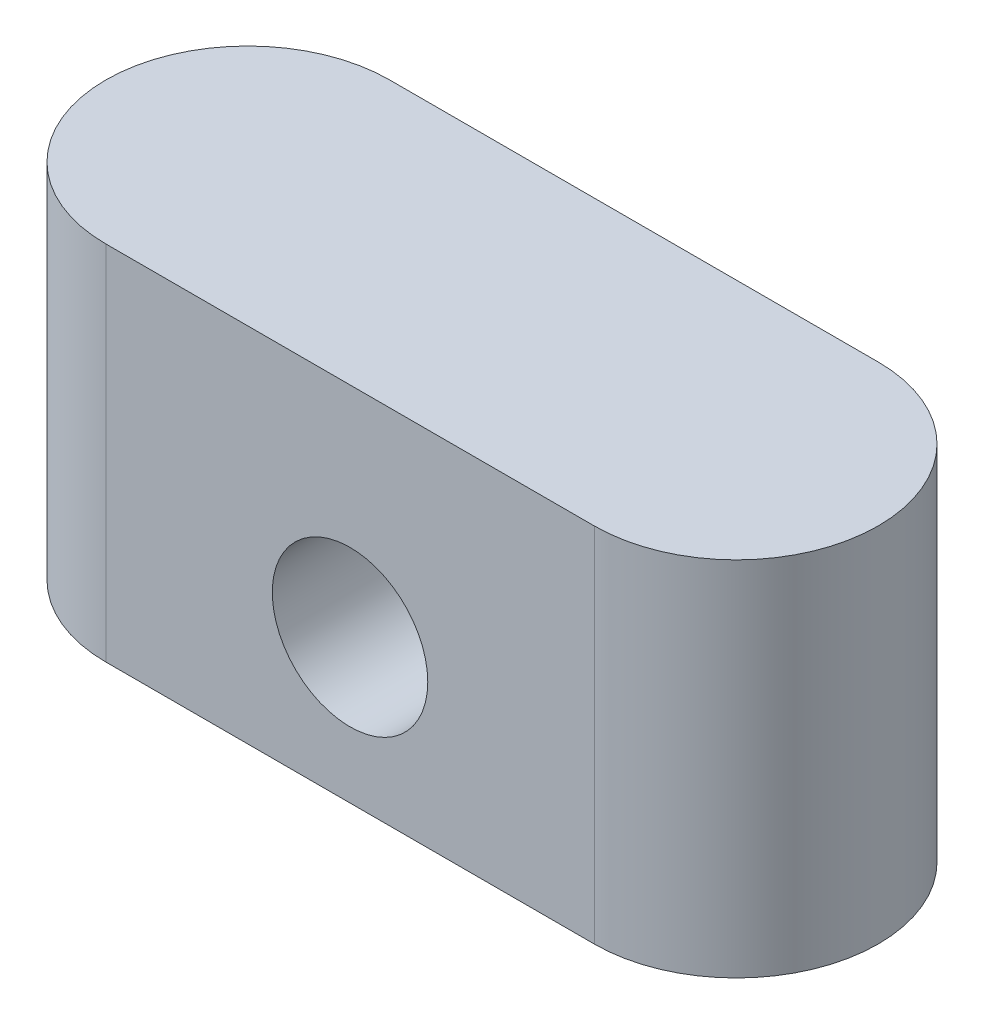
SolidWorks part; units mm, degrees
ref_plane "Front Plane" through (0, 0, 0) normal (0, 0, 1) x (1, 0, 0)
ref_plane "Top Plane" through (0, 0, 0) normal (0, 1, 0) x (1, 0, 0)
ref_plane "Right Plane" through (0, 0, 0) normal (1, 0, 0) x (0, 0, -1)
sketch "Sketch1" plane through (0, 0, 0) normal (0, 1, 0) x (1, 0, 0)
  line L0 (-4.25, 0) -> (4.25, 0) construction
  line L1 (-4.25, 2.4701) -> (4.25, 2.4702)
  line L2 (-4.25, -2.4701) -> (4.25, -2.4701)
  arc A0 (-4.25, 2.4701) -> (-4.25, -2.4701) centre (-4.25, 0) ccw
  arc A1 (4.25, -2.4701) -> (4.25, 2.4702) centre (4.25, 0) ccw
  point P2 (0, 0)
  dimension "D1" = 8.5
  dimension "D2" = 4.9403
extrude "Boss-Extrude1" add sketch "Sketch1" along normal mid plane 6.3
hole_wizard "#6-32 Tapped Hole1" positions "Sketch3" profile "Sketch2" tap size "#6-32" standard "ANSI Inch"
sketch "Sketch3" plane through (0, 0, 2.4701) normal (0, 0, 1) x (1, 0, 0)
  line L0 (-4.25, -3.15) -> (4.25, -3.15) construction
  point P0 (0, -0.65)
  dimension "D1" = 2.5
sketch "Sketch2" plane through (0, -0.65, 2.4701) normal (1, 0, 0) x (0, -1, 0)
  line L0 (0, 0) -> (0, 4.9403)
  line L1 (0, 4.9403) -> (1.3525, 4.9403)
  line L2 (1.3525, 4.9403) -> (1.3525, 0)
  line L5 (1.3525, 0) -> (0, 0)
  line L11 (0, -6.35) -> (0, 107.95) construction
  dimension "Thru Tap Drill Dia." = 2.7051
  dimension "Thru Tap Drill Depth" = 4.9403
